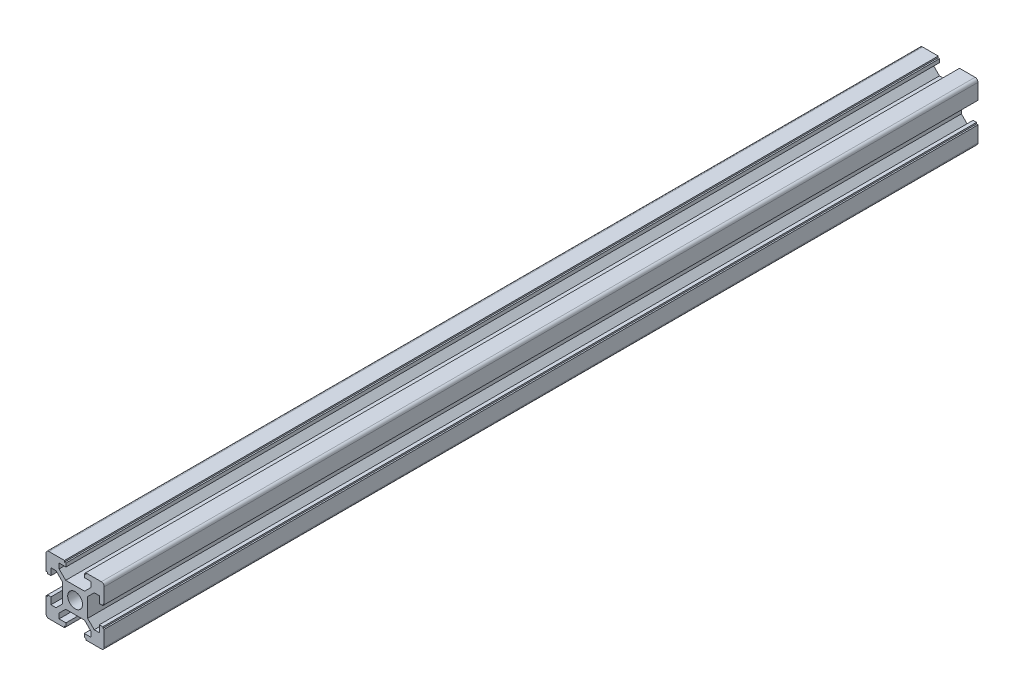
SolidWorks part; units mm, degrees
ref_plane "前视基准面" through (0, 0, 0) normal (0, 0, 1) x (1, 0, 0)
ref_plane "上视基准面" through (0, 0, 0) normal (0, 1, 0) x (1, 0, 0)
ref_plane "右视基准面" through (0, 0, 0) normal (1, 0, 0) x (0, 0, -1)
sketch "草图1" plane through (0, 0, 0) normal (0, 0, 1) x (1, 0, 0)
  line B0 (-9, -10) -> (-3.65, -10)
  line B1 (-3.65, -10) -> (-3.65, -9.5)
  line B2 (-3.65, -9.5) -> (-3.15, -9.5)
  line B3 (-3.15, -9.5) -> (-3.15, -8.3)
  line B4 (-3.15, -8.3) -> (-5.5, -8.3)
  line B5 (-5.5, -8.3) -> (-5.5, -6.5607)
  line B6 (-5.5, -6.5607) -> (-3.2393, -4.3)
  line B7 (-3.2393, -4.3) -> (0, -4.3)
  line B8 (0, -4.3) -> (3.2393, -4.3)
  line B9 (3.2393, -4.3) -> (5.5, -6.5607)
  line B10 (5.5, -6.5607) -> (5.5, -8.3)
  line B11 (5.5, -8.3) -> (3.15, -8.3)
  line B12 (3.15, -8.3) -> (3.15, -9.5)
  line B13 (3.15, -9.5) -> (3.65, -9.5)
  line B14 (3.65, -9.5) -> (3.65, -10)
  line B15 (3.65, -10) -> (9, -10)
  line B16 (10, -9) -> (10, -3.65)
  line B17 (10, -3.65) -> (9.5, -3.65)
  line B18 (9.5, -3.65) -> (9.5, -3.15)
  line B19 (9.5, -3.15) -> (8.3, -3.15)
  line B20 (8.3, -3.15) -> (8.3, -5.5)
  line B21 (8.3, -5.5) -> (6.5607, -5.5)
  line B22 (6.5607, -5.5) -> (4.3, -3.2393)
  line B23 (4.3, -3.2393) -> (4.3, 0)
  line B24 (4.3, 0) -> (4.3, 3.2393)
  line B25 (4.3, 3.2393) -> (6.5607, 5.5)
  line B26 (6.5607, 5.5) -> (8.3, 5.5)
  line B27 (8.3, 5.5) -> (8.3, 3.15)
  line B28 (8.3, 3.15) -> (9.5, 3.15)
  line B29 (9.5, 3.15) -> (9.5, 3.65)
  line B30 (9.5, 3.65) -> (10, 3.65)
  line B31 (10, 3.65) -> (10, 9)
  line B32 (9, 10) -> (3.65, 10)
  line B33 (3.65, 10) -> (3.65, 9.5)
  line B34 (3.65, 9.5) -> (3.15, 9.5)
  line B35 (3.15, 9.5) -> (3.15, 8.3)
  line B36 (3.15, 8.3) -> (5.5, 8.3)
  line B37 (5.5, 8.3) -> (5.5, 6.5607)
  line B38 (5.5, 6.5607) -> (3.2393, 4.3)
  line B39 (3.2393, 4.3) -> (0, 4.3)
  line B40 (0, 4.3) -> (-3.2393, 4.3)
  line B41 (-3.2393, 4.3) -> (-5.5, 6.5607)
  line B42 (-5.5, 6.5607) -> (-5.5, 8.3)
  line B43 (-5.5, 8.3) -> (-3.15, 8.3)
  line B44 (-3.15, 8.3) -> (-3.15, 9.5)
  line B45 (-3.15, 9.5) -> (-3.65, 9.5)
  line B46 (-3.65, 9.5) -> (-3.65, 10)
  line B47 (-3.65, 10) -> (-9, 10)
  line B48 (-10, 9) -> (-10, 3.65)
  line B49 (-10, 3.65) -> (-9.5, 3.65)
  line B50 (-9.5, 3.65) -> (-9.5, 3.15)
  line B51 (-9.5, 3.15) -> (-8.3, 3.15)
  line B52 (-8.3, 3.15) -> (-8.3, 5.5)
  line B53 (-8.3, 5.5) -> (-6.5607, 5.5)
  line B54 (-6.5607, 5.5) -> (-4.3, 3.2393)
  line B55 (-4.3, 3.2393) -> (-4.3, 0)
  line B56 (-4.3, 0) -> (-4.3, -3.2393)
  line B57 (-4.3, -3.2393) -> (-6.5607, -5.5)
  line B58 (-6.5607, -5.5) -> (-8.3, -5.5)
  line B59 (-8.3, -5.5) -> (-8.3, -3.15)
  line B60 (-8.3, -3.15) -> (-9.5, -3.15)
  line B61 (-9.5, -3.15) -> (-9.5, -3.65)
  line B62 (-9.5, -3.65) -> (-10, -3.65)
  line B63 (-10, -3.65) -> (-10, -9)
  arc B64 (-1.8031, -1.8031) -> (0, -2.55) centre (0, 0) ccw
  arc B65 (0, -2.55) -> (1.8031, -1.8031) centre (0, 0) ccw
  arc B66 (1.8031, -1.8031) -> (2.55, 0) centre (0, 0) ccw
  arc B67 (2.55, 0) -> (1.8031, 1.8031) centre (0, 0) ccw
  arc B68 (1.8031, 1.8031) -> (0, 2.55) centre (0, 0) ccw
  arc B69 (0, 2.55) -> (-1.8031, 1.8031) centre (0, 0) ccw
  arc B70 (-1.8031, 1.8031) -> (-2.55, 0) centre (0, 0) ccw
  arc B71 (-2.55, 0) -> (-1.8031, -1.8031) centre (0, 0) ccw
  arc B72 (-10, -9) -> (-9, -10) centre (-9, -9) ccw
  arc B73 (9, -10) -> (10, -9) centre (9, -9) ccw
  arc B74 (10, 9) -> (9, 10) centre (9, 9) ccw
  arc B75 (-9, 10) -> (-10, 9) centre (-9, 9) ccw
sketch_block_instance "A$C526775B4-1"
sketch_block "A$C526775B4"
extrude "凸台-拉伸1" add sketch "草图1" along normal mid plane 300
